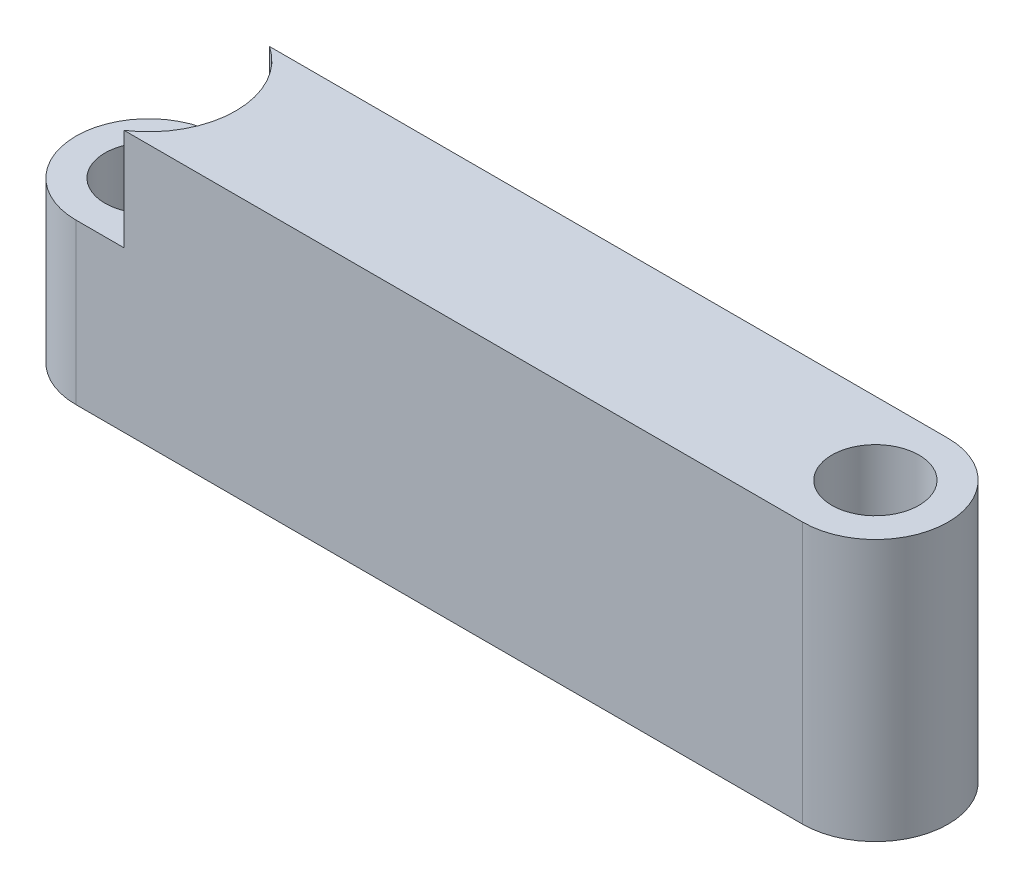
SolidWorks part; units mm, degrees
ref_plane "Front Plane" through (0, 0, 0) normal (0, 0, 1) x (1, 0, 0)
ref_plane "Top Plane" through (0, 0, 0) normal (0, 1, 0) x (1, 0, 0)
ref_plane "Right Plane" through (0, 0, 0) normal (1, 0, 0) x (0, 0, -1)
sketch "Sketch1" plane through (0, 0, 0) normal (0, 1, 0) x (1, 0, 0)
  line L0 (-10.9828, 2.5) -> (14.0172, 2.5)
  line L1 (-10.9828, -2.5) -> (14.0172, -2.5)
  circle A0 centre (-10.9828, 0) radius 2.5
  circle A1 centre (14.0172, 0) radius 2.5
  circle A2 centre (-10.9828, 0) radius 1.5
  circle A3 centre (14.0172, 0) radius 1.5
  dimension "D2" = 5
  dimension "D3" = 5
  dimension "D4" = 3
  dimension "D5" = 3
  dimension "D1" = 25
extrude "Boss-Extrude2" add sketch "Sketch1" along normal blind 9 contours A0 A2 | A1 L0 A0 L1 | A1 A3
sketch "Sketch3" plane through (0, 9, 0) normal (0, 1, 0) x (1, 0, 0)
  circle A0 centre (-10.9828, 0) radius 3
  dimension "D1" = 6
extrude "Cut-Extrude1" cut sketch "Sketch3" against normal blind 3.5
